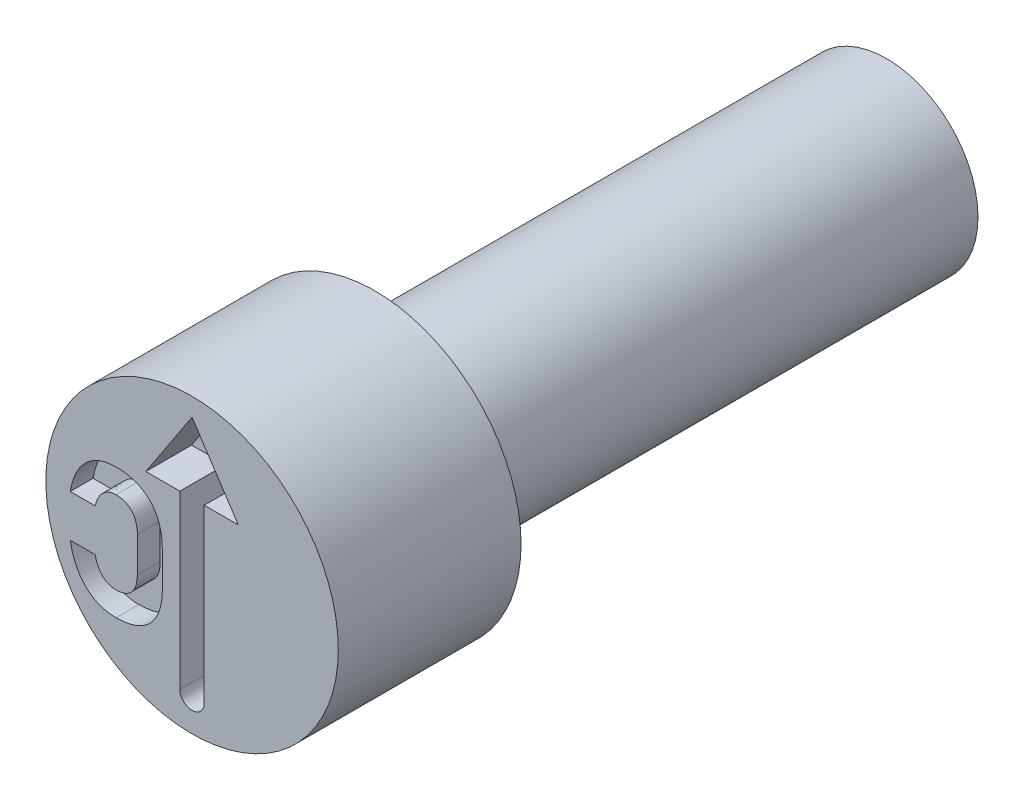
SolidWorks part; units mm, degrees
ref_plane "Front Plane" through (0, 0, 0) normal (0, 0, 1) x (1, 0, 0)
ref_plane "Top Plane" through (0, 0, 0) normal (0, 1, 0) x (1, 0, 0)
ref_plane "Right Plane" through (0, 0, 0) normal (1, 0, 0) x (0, 0, -1)
sketch "Sketch2" plane through (0, 0, 0) normal (1, 0, 0) x (0, 0, -1)
  line L0 (0.4039, 0) -> (50000.4039, 0) construction
  line L6 (0, 0.8) -> (0, 0)
  line L7 (1, 0.8) -> (0, 0.8)
  line L8 (1, 0.5) -> (1, 0.8)
  line L9 (3.8, 0.5) -> (1, 0.5)
  line L10 (3.8, 0) -> (3.8, 0.5)
  line L11 (0, 0) -> (3.8, 0)
  dimension "D1" = 1.6
  dimension "D2" = 1
  dimension "D3" = 3.8
  dimension "D4" = 1
revolve "Revolve1" add sketch "Sketch2" angle 360 about L0
sketch "Sketch3" plane through (0, 0, 0) normal (0, 0, 1) x (1, 0, 0)
  line L0 (0, 0) -> (0, 35000) construction
  line L1 (0.0667, 0.3172) -> (0.0667, -0.6217)
  line L2 (0.2527, 0.3172) -> (0.0667, 0.3172)
  line L3 (0, 0.7007) -> (0.2527, 0.3172)
  line L15 (0, 0.7007) -> (-0.2527, 0.3172)
  line L16 (-0.2527, 0.3172) -> (-0.0667, 0.3172)
  line L17 (-0.0667, 0.3172) -> (-0.0667, -0.6217)
  arc A2 (-0.0667, -0.6217) -> (0.0667, -0.6217) centre (0, -0.6217) ccw
extrude "Cut-Extrude4" cut sketch "Sketch3" against normal blind 0.25
sketch "Sketch4" plane through (0, 0, 0) normal (0, 0, 1) x (1, 0, 0)
  text T0 "C" font "Bahnschrift" height 0.7
  dimension "D1" = 0.1
  dimension "D2" = 0.45
extrude "Cut-Extrude5" cut sketch "Sketch4" against normal blind 0.125
